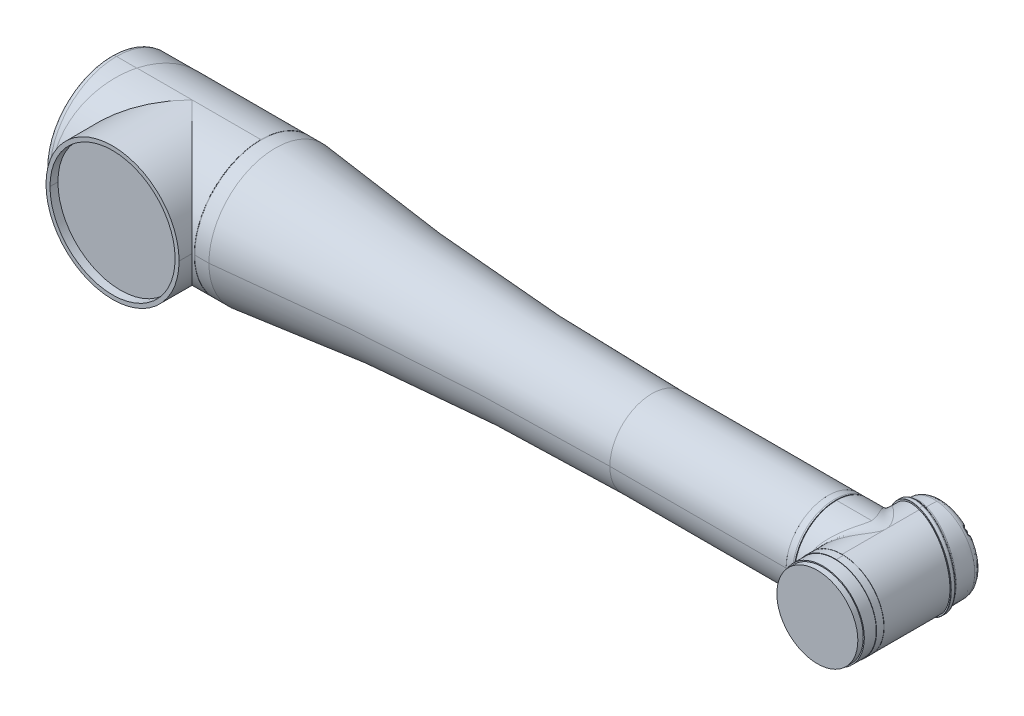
SolidWorks part; units mm, degrees
ref_plane "前视基准面" through (0, 0, 0) normal (0, 0, 1) x (1, 0, 0)
ref_plane "上视基准面" through (0, 0, 0) normal (0, 1, 0) x (1, 0, 0)
ref_plane "右视基准面" through (0, 0, 0) normal (1, 0, 0) x (0, 0, -1)
imported_body "输入1"
sketch "草图1" plane through (0, 0, 62) normal (0, 0, 1) x (1, 0, 0)
  circle A0 centre (582.2194, 13.478) radius 57.5
  dimension "D1" = 115
extrude "凸台-拉伸1" add sketch "草图1" along normal blind 16.5
sketch "草图2" plane through (0, 0, 78.5) normal (0, 0, 1) x (1, 0, 0)
  circle A0 centre (582.2194, 13.478) radius 56
  dimension "D1" = 112
extrude "凸台-拉伸2" add sketch "草图2" along normal blind 7.5
